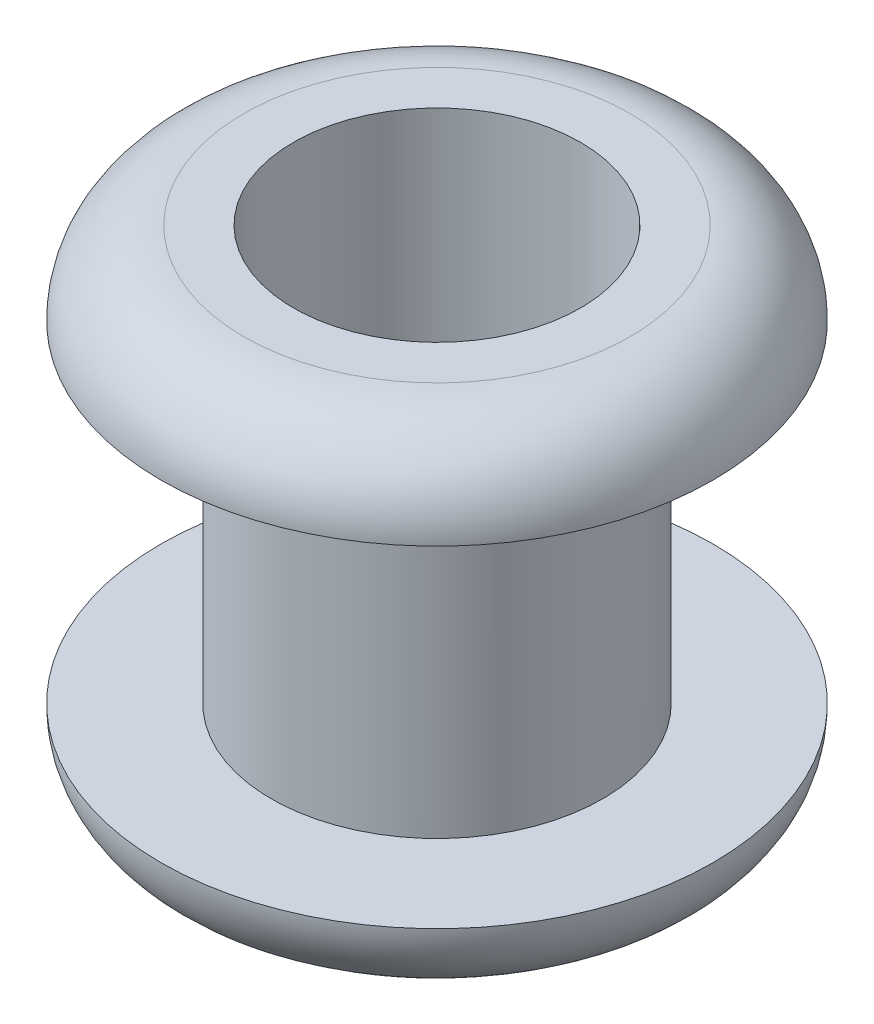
SolidWorks part; units mm, degrees
ref_plane "Front" through (0, 0, 0) normal (0, 0, 1) x (1, 0, 0)
ref_plane "Top" through (0, 0, 0) normal (0, 1, 0) x (1, 0, 0)
ref_plane "Right" through (0, 0, 0) normal (1, 0, 0) x (0, 0, -1)
sketch "Sketch1" plane through (0, 0, 0) normal (0, 1, 0) x (1, 0, 0)
  circle A0 centre (0, 0) radius 1.5
  circle A1 centre (0, 0) radius 1.2
  dimension "D1" = 3
  dimension "D2" = 0.3
extrude "Extrude1" add sketch "Sketch1" along normal blind 3
sketch "Sketch2" plane through (0, 3, 0) normal (0, 1, 0) x (-1, 0, 0)
  circle A0 centre (0, 0) radius 2.5
extrude "Extrude2" add sketch "Sketch2" along normal blind 0.75
sketch "Sketch3" plane through (0, 0, 0) normal (0, -1, 0) x (1, 0, 0)
  circle A0 centre (0, 0) radius 2.5
extrude "Extrude3" add sketch "Sketch3" along normal blind 0.75
sketch "Sketch4" plane through (0, -0.75, 0) normal (0, -1, 0) x (1, 0, 0)
  circle A0 centre (0, 0) radius 1.3
extrude "Cut-Extrude1" cut sketch "Sketch4" against normal through all
fillet "Fillet1" radius 0.75 2 edges at (0, -0.75, -2.5) (0, 3.75, 2.5)
